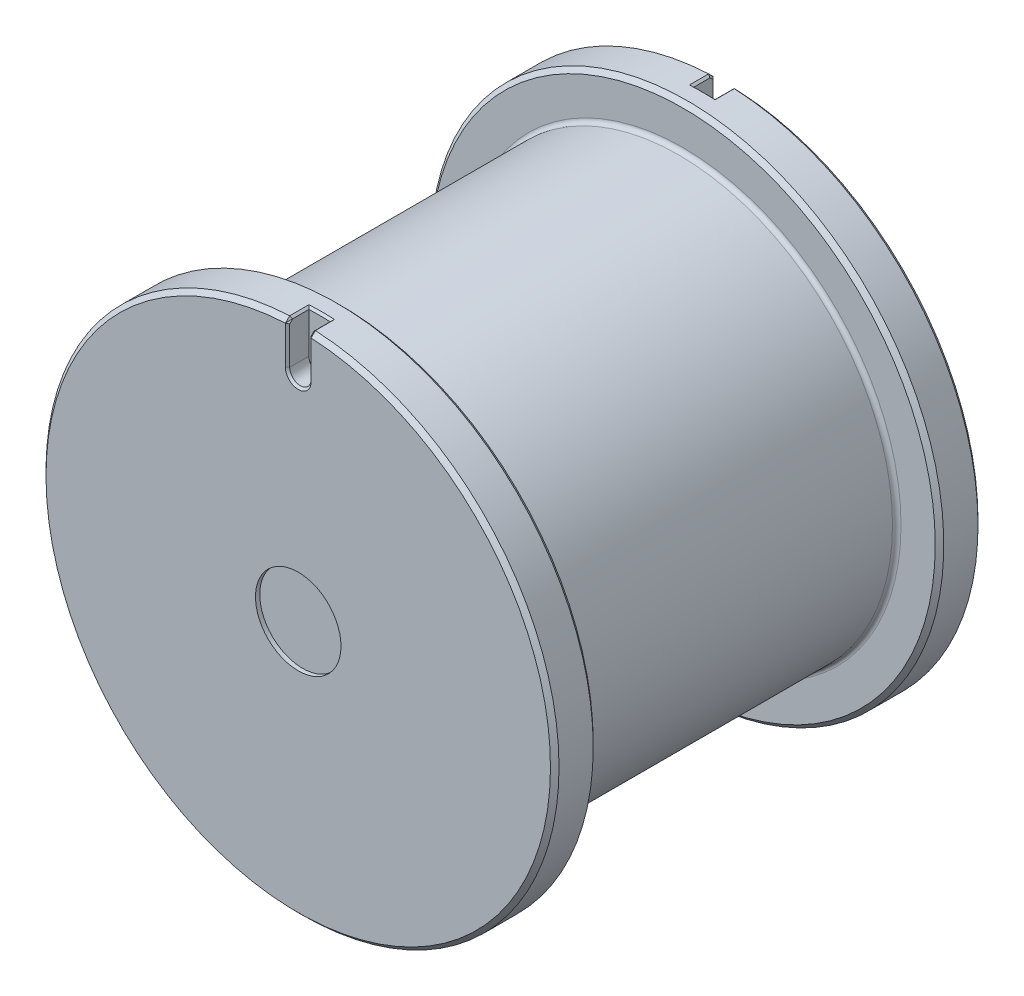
SolidWorks part; units mm, degrees
ref_plane "Ebene1" through (0, 0, 0) normal (0, 0, 1) x (1, 0, 0)
ref_plane "Ebene2" through (0, 0, 0) normal (0, 1, 0) x (1, 0, 0)
ref_plane "Ebene3" through (0, 0, 0) normal (1, 0, 0) x (0, 0, -1)
imported_body "Importiert1"
surface "Oberfläche-Offset1" parameters "D1"=0
split "Abspalten1"
